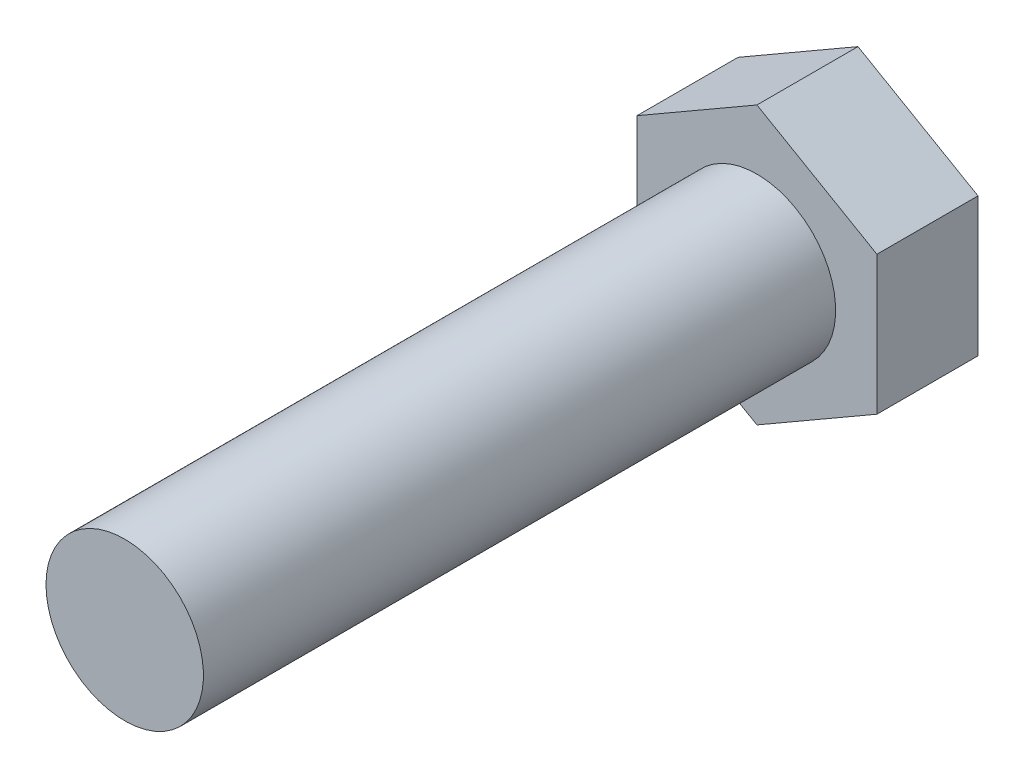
SolidWorks part; units mm, degrees
ref_plane "Plane1" through (0, 0, 0) normal (0, 0, 1) x (1, 0, 0)
ref_plane "Plane2" through (0, 0, 0) normal (0, 1, 0) x (1, 0, 0)
ref_plane "Plane3" through (0, 0, 0) normal (1, 0, 0) x (0, 0, -1)
sketch "Sketch1" plane through (0, 0, 0) normal (0, 0, 1) x (1, 0, 0)
  line L1 (0, 8.1829) -> (-7.0866, 4.0915)
  line L2 (-7.0866, 4.0915) -> (-7.0866, -4.0915)
  line L3 (-7.0866, -4.0915) -> (0, -8.1829)
  line L4 (0, -8.1829) -> (7.0866, -4.0915)
  line L5 (7.0866, -4.0915) -> (7.0866, 4.0915)
  line L6 (7.0866, 4.0915) -> (0, 8.1829)
  circle A0 centre (0, 0) radius 7.0866 construction
  dimension "D1" = 14.1732
extrude "Base-Extrude" add sketch "Sketch1" along normal blind 5.969
sketch "Sketch2" plane through (0, 0, 5.969) normal (0, 0, 1) x (1, 0, 0)
  circle A0 centre (0, 0) radius 4.6482
  dimension "D1" = 9.2964
extrude "Boss-Extrude1" add sketch "Sketch2" along normal blind 37.338
